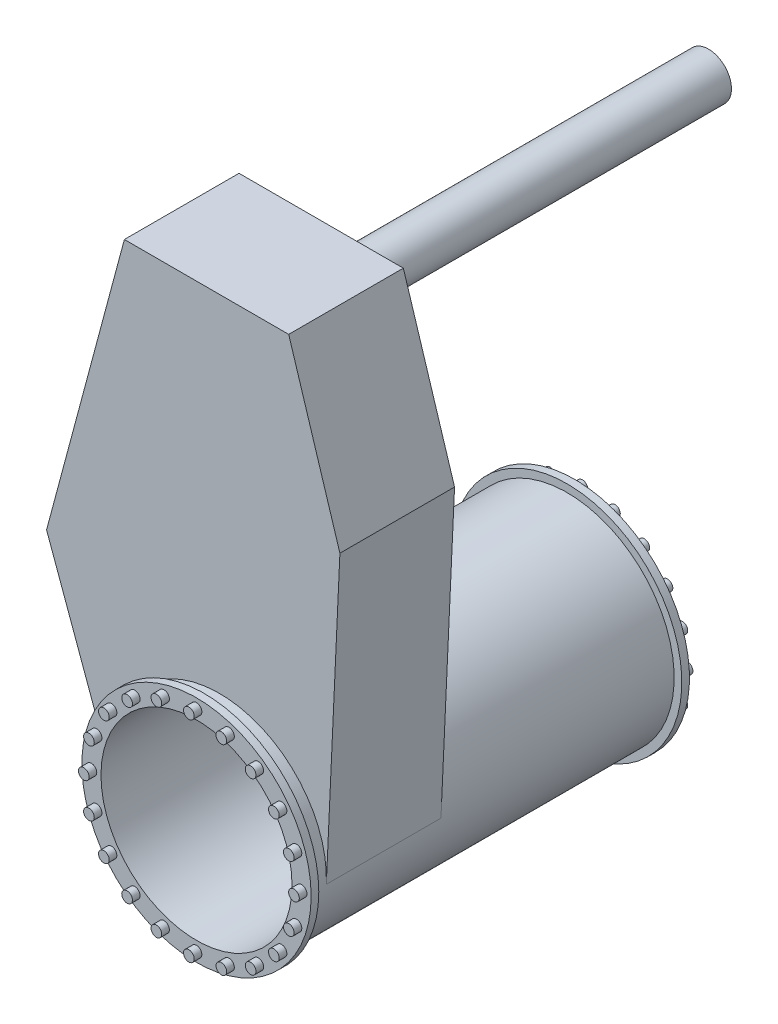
SolidWorks part; units mm, degrees
ref_plane "Front Plane" through (0, 0, 0) normal (0, 0, 1) x (1, 0, 0)
ref_plane "Top Plane" through (0, 0, 0) normal (0, 1, 0) x (1, 0, 0)
ref_plane "Right Plane" through (0, 0, 0) normal (1, 0, 0) x (0, 0, -1)
sketch "Sketch1" plane through (0, 0, 0) normal (0, 0, 1) x (1, 0, 0)
  circle A0 centre (0, 0) radius 125
  circle A1 centre (0, 0) radius 150
  dimension "D1" = 300
  dimension "D2" = 250
extrude "Boss-Extrude1" add sketch "Sketch1" along normal blind 10
sketch "Sketch2" plane through (0, 0, 10) normal (0, 0, 1) x (1, 0, 0)
  circle A0 centre (0, 0) radius 137.5
  circle A1 centre (0, 137.5) radius 7
extrude "Boss-Extrude2" add sketch "Sketch2" along normal blind 10 contours A0 A1 | A0 A1
pattern_circular "CirPattern1" count 20 over 360 about axis through (0, 0, 0) along (0, 0, 1) of "Boss-Extrude2"
sketch "Sketch5" plane through (0, 0, 0) normal (0, 0, -1) x (-1, 0, 0)
  circle A0 centre (0, 0) radius 140
  circle A1 centre (0, 0) radius 125
extrude "Boss-Extrude3" add sketch "Sketch5" along normal blind 20
sketch "Sketch6" plane through (0, 0, -20) normal (0, 0, -1) x (-1, 0, 0)
  line L0 (131.557, -47.8828) -> (226.1892, 212.1172)
  line L1 (226.1892, 212.1172) -> (124.3685, 592.1172)
  line L6 (0, 0) -> (0, 204.5296) construction
  line L7 (124.3685, 592.1172) -> (-90.6315, 592.1172)
  line L8 (-90.6315, 592.1172) -> (-157.6411, 377.6057)
  line L9 (-157.6411, 377.6057) -> (-139.85, -6.478)
  arc A0 (-139.85, -6.478) -> (131.557, -47.8828) centre (0, 0) ccw
  circle A1 centre (0, 0) radius 125
  dimension "D1" = 215
  dimension "D2" = 20
  dimension "D3" = 260
  dimension "D4" = 145
  dimension "D5" = 380
  dimension "D6" = 160
extrude "Boss-Extrude4" add sketch "Sketch6" along normal blind 150
sketch "Sketch7" plane through (0, 0, -170) normal (0, 0, -1) x (-1, 0, 0)
  circle A0 centre (0, 0) radius 140
  circle A1 centre (0, 0) radius 125
extrude "Boss-Extrude5" add sketch "Sketch7" along normal blind 305
sketch "Sketch8" plane through (0, 0, -475) normal (0, 0, -1) x (-1, 0, 0)
  circle A0 centre (0, 0) radius 125
  circle A1 centre (0, 0) radius 150
extrude "Boss-Extrude6" add sketch "Sketch8" along normal blind 10
sketch "Sketch9" plane through (0, 0, -485) normal (0, 0, -1) x (-1, 0, 0)
  circle A1 centre (0, 137.5) radius 7
  dimension "D1" = 14
  dimension "D2" = 137.5
extrude "Boss-Extrude7" add sketch "Sketch9" along normal blind 10
pattern_circular "CirPattern2" count 20 over 360 about axis through (0, 0, 0) along (0, 0, 1) of "Boss-Extrude7"
sketch "Sketch10" plane through (0, 0, -170) normal (0, 0, -1) x (-1, 0, 0)
  circle A0 centre (0, 520) radius 30
  dimension "D1" = 60
  dimension "D2" = 520
extrude "Cut-Extrude1" cut sketch "Sketch10" against normal blind 20
sketch "Sketch12" plane through (0, 0, -150) normal (0, 0, -1) x (-1, 0, 0)
  circle A0 centre (0, 520) radius 30
extrude "Boss-Extrude8" add sketch "Sketch12" along normal blind 510
